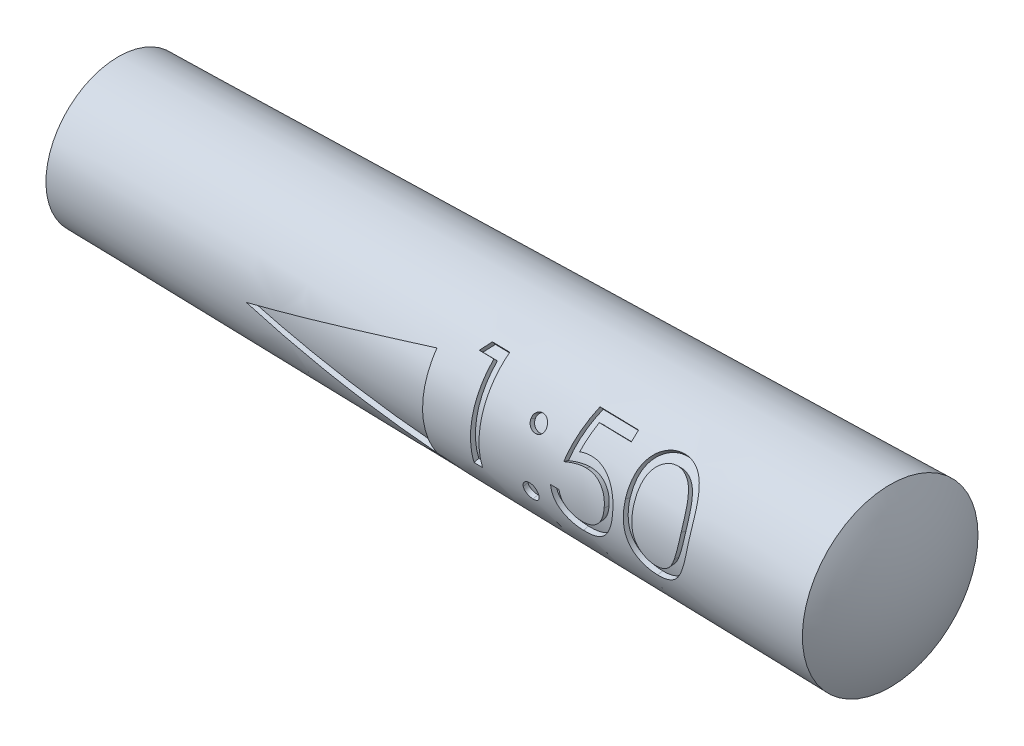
SolidWorks part; units mm, degrees
ref_plane "Front Plane" through (0, 0, 0) normal (0, 0, 1) x (1, 0, 0)
ref_plane "Top Plane" through (0, 0, 0) normal (0, 1, 0) x (1, 0, 0)
ref_plane "Right Plane" through (0, 0, 0) normal (1, 0, 0) x (0, 0, -1)
sketch "Sketch1" plane through (0, 0, 0) normal (1, 0, 0) x (0, 0, -1)
  circle A0 centre (0, 0) radius 0.75
  dimension "D1" = 1.5
extrude "Extrude1" add sketch "Sketch1" along normal mid plane 8
draft "Draft1" type of draft neutral plane draft angle 1.146 faces to draft 1 parameters "D1"=1.146
sketch "Sketch2" plane through (0, 0, 0) normal (0, 0, 1) x (1, 0, 0)
  line L0 (-4, 0) -> (-4, 0.75)
  line L1 (-4, 0.75) -> (-4, -0.75) construction
  line L2 (-4, 0) -> (-4.23, 0)
  line L3 (-4.23, 0) -> (-4.23, -0.83) construction
  line L4 (4, 0) -> (4, 0.91)
  line L5 (4, -0.91) -> (4, 0.91) construction
  line L6 (4, 0) -> (4.23, 0)
  line L7 (4.23, 0) -> (4.23, -0.83) construction
  line L8 (-4, -0.75) -> (4, -0.91) construction
  arc A0 (-4.23, 0) -> (-4, 0.75) centre (-2.8922, 0) cw
  arc A1 (4.23, 0) -> (4, 0.91) centre (2.3148, 0) ccw
  point P14 (0, -0.83)
revolve "Revolve1" add sketch "Sketch2" angle 360 about L2
sketch "Sketch5" plane through (0, 0, 0) normal (0, 0, 1) x (1, 0, 0)
  line L0 (0, 0.83) -> (0, -0.83) construction
  line L1 (4, 0.91) -> (-4, 0.75) construction
  line L2 (-4, -0.75) -> (4, -0.91) construction
ref_plane "Plane2" through (0, 0, 0) normal (-0.02, 0, 0.9998) x (0.9998, 0, 0.02)
sketch "Sketch6" plane through (0, 0, 0) normal (-0.02, 0, 0.9998) x (0.9998, 0, 0.02)
  line L0 (0, 0) -> (0, 0.5)
  line L1 (0, 0.83) -> (0, -0.83) construction
  line L2 (0, 0.5) -> (-1.866, 0)
  line L3 (-1.866, 0) -> (0, -0.5)
  line L4 (0, -0.5) -> (0, 0)
  line L5 (0, -0.25) -> (3, -0.25) construction
  text T0 "1:50" font "Century Gothic" height 1
  dimension "D1" = 1
  dimension "D2" = 30
  dimension "D3" = 3
wrap "Wrap2" sketch "Sketch6" wrap type deboss source sketch "Sketch6" thickness 0.05 parameters "D1"=0.05
equation "\"D2@Sketch2\" = \"D1@Sketch2\""
